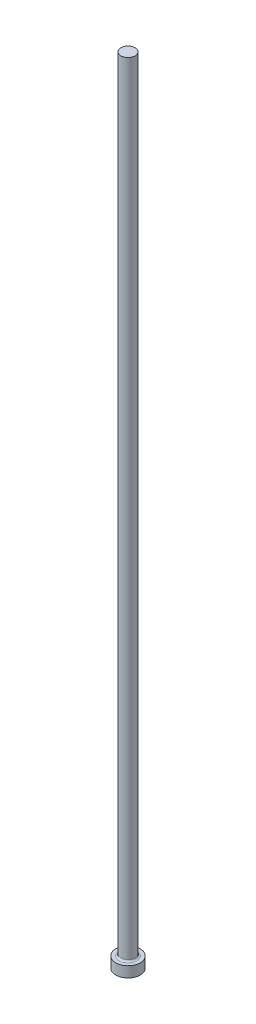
SolidWorks part; units mm, degrees
ref_plane "Front Plane" through (0, 0, 0) normal (0, 0, 1) x (1, 0, 0)
ref_plane "Top Plane" through (0, 0, 0) normal (0, 1, 0) x (1, 0, 0)
ref_plane "Right Plane" through (0, 0, 0) normal (1, 0, 0) x (0, 0, -1)
sketch "Sketch1" plane through (0, 0, 0) normal (0, 0, 1) x (1, 0, 0)
  line L0 (0, 0) -> (5.461, 0)
  line L1 (55, 0) -> (-55, 0) construction
  line L2 (5.461, 0) -> (5.461, 4.7498)
  line L3 (5.461, 4.7498) -> (3.937, 4.7498)
  line L4 (3.175, 5.5118) -> (3.175, 355.6)
  line L5 (3.175, 355.6) -> (0, 355.6)
  line L6 (0, 355.6) -> (0, 0)
  arc A0 (3.937, 4.7498) -> (3.175, 5.5118) centre (3.937, 5.5118) cw
  dimension "D5" = 0.762
  dimension "D1" = 3.175
  dimension "D2" = 5.461
  dimension "D3" = 4.7498
  dimension "D4" = 355.6
revolve "Revolve1" add sketch "Sketch1" angle 360 about L6
